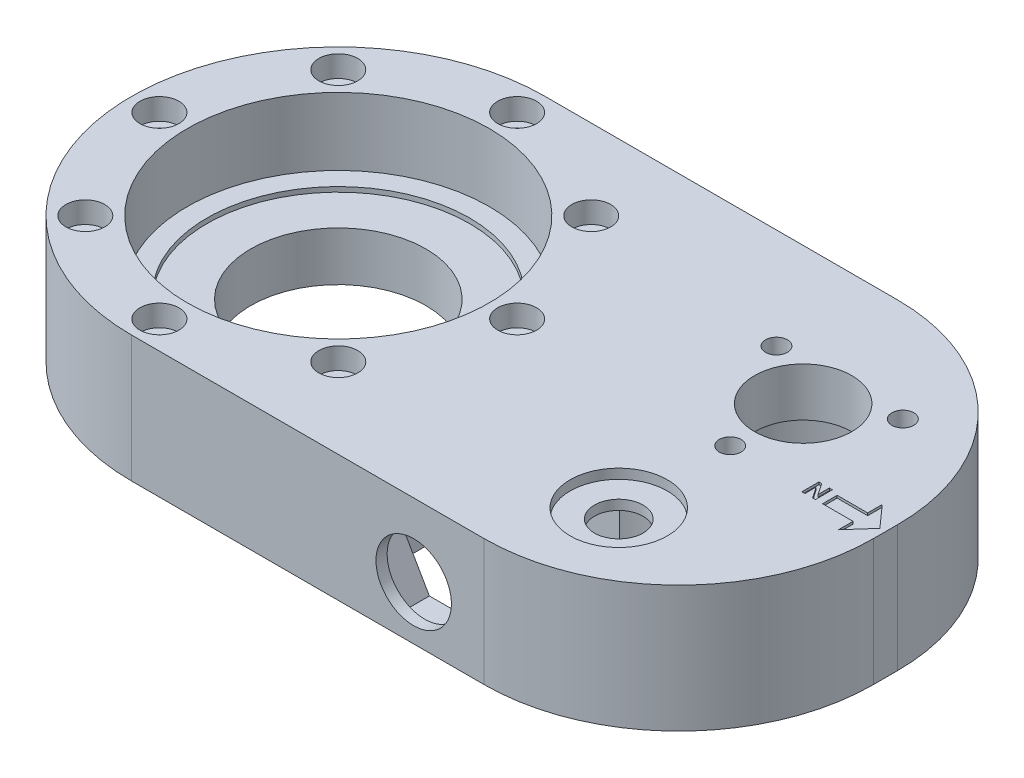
SolidWorks part; units mm, degrees
ref_plane "Piano frontale" through (0, 0, 0) normal (0, 0, 1) x (1, 0, 0)
ref_plane "Piano superiore" through (0, 0, 0) normal (0, 1, 0) x (1, 0, 0)
ref_plane "Piano destro" through (0, 0, 0) normal (1, 0, 0) x (0, 0, -1)
sketch "Schizzo1" plane through (0, 0, 0) normal (0, 1, 0) x (1, 0, 0)
  line L0 (0, -42.5) -> (72.5, -42.5)
  line L1 (112.5, -2.5) -> (112.5, 2.5)
  line L2 (72.5, 42.5) -> (0, 42.5)
  arc A0 (0, 42.5) -> (0, -42.5) centre (0, 0) ccw
  circle A1 centre (0, 0) radius 18
  arc A2 (72.5, 42.5) -> (112.5, 2.5) centre (72.5, 2.5) cw
  arc A3 (112.5, -2.5) -> (72.5, -42.5) centre (72.5, -2.5) cw
  dimension "D1" = 85
  dimension "D2" = 36
  dimension "D4" = 40
  dimension "D3" = 112.5
  dimension "D5" = 72.5
extrude "Estrusione-Estrusione1" add sketch "Schizzo1" along normal blind 26
sketch "Schizzo2" plane through (0, 0, 0) normal (0, -1, 0) x (1, 0, 0)
  circle A0 centre (0, 0) radius 27
  dimension "D1" = 54
extrude "Taglio-Estrusione1" cut sketch "Schizzo2" against normal blind 1
sketch "Schizzo3" plane through (0, 26, 0) normal (0, 1, 0) x (1, 0, 0)
  circle A0 centre (0, 0) radius 31.05
  dimension "D1" = 62.1
extrude "Taglio-Estrusione2" cut sketch "Schizzo3" against normal blind 13.9
sketch "Schizzo4" plane through (0, 12.1, 0) normal (0, 1, 0) x (1, 0, 0)
  circle A0 centre (0, 0) radius 27
  dimension "D1" = 54
extrude "Taglio-Estrusione3" cut sketch "Schizzo4" against normal blind 1
hole_wizard "Foro lamato per Vite M4 a testa cilindrica-1" positions "Schizzo7" profile "Schizzo8" counterbore size "M4" standard "ISO"
sketch "Schizzo7" plane through (0, 26, 0) normal (0, 1, 0) x (1, 0, 0)
  line L0 (-31.05, 0) -> (-42.5, 0) construction
  circle A0 centre (0, 0) radius 31.05 construction
  circle A1 centre (0, 0) radius 31.05 construction
  circle A2 centre (0, 0) radius 42.5 construction
  point P31 (-36.775, 0)
  point P37 (-26.0039, 26.0039)
  point P38 (0, 36.775)
  point P39 (26.0039, 26.0039)
  point P40 (36.775, 0)
  point P41 (26.0039, -26.0039)
  point P42 (0, -36.775)
  point P43 (-26.0039, -26.0039)
  point P44 (0, 0)
  dimension "D1" = 8
sketch "Schizzo8" plane through (0, 26, 0) normal (1, 0, 0) x (0, 0, 1)
  line L0 (0, 0) -> (0, 26)
  line L1 (0, 26) -> (2.25, 26)
  line L3 (2.25, 26) -> (2.25, 4.4)
  line L4 (2.25, 4.4) -> (4, 4.4)
  line L5 (4, 4.4) -> (4, 0)
  line L7 (4, 0) -> (0, 0)
  line L11 (0, -6.35) -> (0, 107.95) construction
  dimension "Thru Hole Dia." = 4.5
  dimension "Thru Hole Depth" = 26
  dimension "C'Bore Dia." = 8
  dimension "C'Bore Depth" = 4.4
sketch "Schizzo10" plane through (0, 0, 0) normal (0, -1, 0) x (1, 0, 0)
  line L0 (0, 0) -> (81.2466, -14.326) construction
  line L2 (0, 0) -> (150.7211, 0) construction
  circle A1 centre (81.2466, -14.326) radius 20.5
  dimension "D1" = 41
  dimension "D2" = 10
  dimension "D3" = 82.5
extrude "Taglio-Estrusione4" cut sketch "Schizzo10" against normal blind 16
sketch "Schizzo11" plane through (0, 16, 0) normal (0, -1, 0) x (1, 0, 0)
  circle A0 centre (81.2466, -14.326) radius 10
  dimension "D1" = 20
extrude "Taglio-Estrusione5" cut sketch "Schizzo11" against normal blind 25
hole_wizard "Foro per Vite M4-2" positions "Schizzo12" profile "Schizzo13" hole size "M4" standard "ISO"
sketch "Schizzo12" plane through (0, 16, 0) normal (0, -1, 0) x (-1, 0, 0)
  circle A0 centre (-81.2466, 14.326) radius 15 construction
  point P5 (-81.2466, -0.674)
  point P11 (-94.237, 21.826)
  point P12 (-68.2563, 21.826)
  point P13 (-81.2466, 14.326)
  dimension "D1" = 30
  dimension "D2" = 3
sketch "Schizzo13" plane through (81.2466, 16, -14.326) normal (1, 0, 0) x (0, 0, -1)
  line L0 (0, 0) -> (0, 10)
  line L1 (0, 10) -> (2.25, 10)
  line L2 (2.25, 10) -> (2.25, 0)
  line L5 (2.25, 0) -> (0, 0)
  line L11 (0, -6.35) -> (0, 107.95) construction
  dimension "Thru Hole Dia." = 4.5
  dimension "Thru Hole Depth" = 10
sketch "Schizzo14" plane through (0, 0, 0) normal (0, -1, 0) x (1, 0, 0)
  line L0 (0, 0) -> (80.8421, 23.1811) construction
  line L1 (0, 0) -> (44.815, 0) construction
  line L2 (80.8421, 23.1811) -> (70.1617, 33.7134) construction
  line L3 (70.1617, 33.7134) -> (45.8421, 33.7134)
  line L4 (41.8421, 29.7134) -> (41.8421, 16.5007)
  line L5 (45.8421, 12.5007) -> (70.3098, 12.5007)
  line L6 (70.3098, 12.5007) -> (80.8421, 23.1811) construction
  line L7 (44.8421, 32.7134) -> (44.8421, 31.7134)
  line L8 (43.8421, 30.7134) -> (42.8421, 30.7134)
  line L9 (42.8421, 15.5007) -> (43.8421, 15.5007)
  line L10 (44.8421, 14.5007) -> (44.8421, 13.5007)
  arc A0 (70.3098, 12.5007) -> (70.1617, 33.7134) centre (80.8421, 23.1811) ccw
  arc A3 (45.8421, 33.7134) -> (44.8421, 32.7134) centre (45.8421, 32.7134) ccw
  arc A4 (45.8421, 12.5007) -> (44.8421, 13.5007) centre (45.8421, 13.5007) cw
  arc A5 (44.8421, 14.5007) -> (43.8421, 15.5007) centre (43.8421, 14.5007) ccw
  arc A6 (41.8421, 16.5007) -> (42.8421, 15.5007) centre (42.8421, 16.5007) ccw
  arc A7 (42.8421, 30.7134) -> (41.8421, 29.7134) centre (42.8421, 29.7134) ccw
  arc A8 (43.8421, 30.7134) -> (44.8421, 31.7134) centre (43.8421, 31.7134) ccw
  dimension "D1" = 30
  dimension "D2" = 84.1
  dimension "D7" = 1
  dimension "D3" = 16
  dimension "D4" = 90
  dimension "D5" = 39
extrude "Taglio-Estrusione6" cut sketch "Schizzo14" against normal blind 22
sketch "Schizzo15" plane through (0, 22, 0) normal (0, -1, 0) x (1, 0, 0)
  circle A0 centre (80.8421, 23.1811) radius 5
  dimension "D1" = 10
extrude "Taglio-Estrusione7" cut sketch "Schizzo15" against normal through all
sketch "Schizzo16" plane through (0, 26, 0) normal (0, 1, 0) x (1, 0, 0)
  line L1 (78.7222, -15.921) -> (73.4947, -21.3869) construction
  line L2 (73.4947, -21.3869) -> (75.6146, -28.647) construction
  line L3 (75.6146, -28.647) -> (82.962, -30.4412) construction
  line L4 (82.962, -30.4412) -> (88.1895, -24.9753) construction
  line L5 (88.1895, -24.9753) -> (86.0696, -17.7152) construction
  line L6 (86.0696, -17.7152) -> (78.7222, -15.921) construction
  circle A0 centre (80.8421, -23.1811) radius 6.55 construction
  circle A1 centre (80.8421, -23.1811) radius 10
  dimension "D2" = 20
  dimension "D1" = 13.1
extrude "Taglio-Estrusione8" cut sketch "Schizzo16" against normal blind 2
sketch "Schizzo17" plane through (0, 0, 33.7134) normal (0, 0, -1) x (-1, 0, 0)
  line L0 (-58.0019, 22) -> (-58.0019, 0) construction
  line L7 (-70.1617, 22) -> (-45.8421, 22) construction
  line L8 (-70.1617, 0) -> (-45.8421, 0) construction
  line L10 (-69.1159, 11) -> (-63.5589, 1.375)
  line L11 (-63.5589, 1.375) -> (-52.4449, 1.375)
  line L12 (-52.4449, 1.375) -> (-46.8879, 11)
  line L13 (-46.8879, 11) -> (-52.4449, 20.625)
  line L14 (-52.4449, 20.625) -> (-63.5589, 20.625)
  line L15 (-63.5589, 20.625) -> (-69.1159, 11)
  circle A0 centre (-58.0019, 11) radius 9.625 construction
  dimension "D1" = 19.25
extrude "Taglio-Estrusione9" cut sketch "Schizzo17" against normal blind 6.5
sketch "Schizzo18" plane through (0, 0, 40.2134) normal (0, 0, -1) x (-1, 0, 0)
  line L0 (-58.0019, 20.625) -> (-58.0019, 1.375) construction
  line L1 (-52.4449, 20.625) -> (-63.5589, 20.625) construction
  line L2 (-63.5589, 1.375) -> (-52.4449, 1.375) construction
  circle A0 centre (-58.0019, 11) radius 7.75
  dimension "D1" = 15.5
extrude "Taglio-Estrusione10" cut sketch "Schizzo18" against normal through all
sketch "Schizzo20" plane through (0, 0, 0) normal (0, -1, 0) x (1, 0, 0)
  line L0 (45.8421, 12.5007) -> (70.3098, 12.5007) construction
  line L1 (55.8421, 12.5007) -> (49.3421, 12.5007)
  line L2 (55.8421, 12.5007) -> (55.8421, 2.5007)
  line L3 (55.8421, 2.5007) -> (49.3421, 2.5007)
  line L4 (49.3421, 12.5007) -> (49.3421, 2.5007)
  line L5 (41.8421, 29.7134) -> (41.8421, 16.5007) construction
  dimension "D1" = 10
  dimension "D2" = 6.5
  dimension "D3" = 7.5
extrude "Taglio-Estrusione11" cut sketch "Schizzo20" against normal blind 6.5
fillet "Raccordo1" radius 6.5 3 edges at (52.5921, 6.5, 2.5007) (55.8421, 3.25, 2.5007) (49.3421, 3.25, 2.5007)
sketch "Schizzo21" plane through (0, 26, 0) normal (0, 1, 0) x (1, 0, 0)
  line L0 (112.5, 0) -> (59.3356, 0) construction
  line L1 (112.5, -2.5) -> (112.5, 2.5) construction
  line L2 (101.0668, 1.5) -> (101.0668, -1.5)
  line L3 (101.0668, 1.5) -> (107.338, 1.5)
  line L4 (107.338, 1.5) -> (107.338, 4.5)
  line L5 (107.338, 4.5) -> (111.3385, 0)
  line L6 (111.3385, 0) -> (107.338, -4.5)
  line L7 (107.338, -4.5) -> (107.338, -1.5)
  line L8 (107.338, -1.5) -> (101.0668, -1.5)
  line L9 (101.0668, -1.5) -> (95.3365, -1.5) construction
  text T0 "<b>N</b>"
  point P8 (101.0668, 0)
  dimension "D1" = 3
  dimension "D2" = 3
extrude "Taglio-Estrusione12" cut sketch "Schizzo21" against normal blind 0.5
sketch "Schizzo26" plane through (0, 22, 0) normal (0, -1, 0) x (1, 0, 0)
  line L0 (45.8421, 12.5007) -> (70.3098, 12.5007) construction
  line L1 (63.5589, 12.5007) -> (66.0589, 12.5007)
  line L2 (63.5589, 12.5007) -> (63.5589, 33.7134)
  line L3 (63.5589, 33.7134) -> (66.0589, 33.7134)
  line L4 (66.0589, 12.5007) -> (66.0589, 33.7134)
  line L5 (70.1617, 33.7134) -> (45.8421, 33.7134) construction
  line L6 (63.5589, 40.2134) -> (63.5589, 33.7134) construction
  line L7 (49.9449, 33.7134) -> (52.4449, 33.7134)
  line L8 (49.9449, 33.7134) -> (49.9449, 12.5007)
  line L9 (49.9449, 12.5007) -> (52.4449, 12.5007)
  line L10 (52.4449, 33.7134) -> (52.4449, 12.5007)
  line L11 (52.4449, 40.2134) -> (52.4449, 33.7134) construction
  dimension "D1" = 2.5
  dimension "D2" = 2.5
extrude "Estrusione-Estrusione2" add sketch "Schizzo26" along normal up to surface (1.375 mm away)
